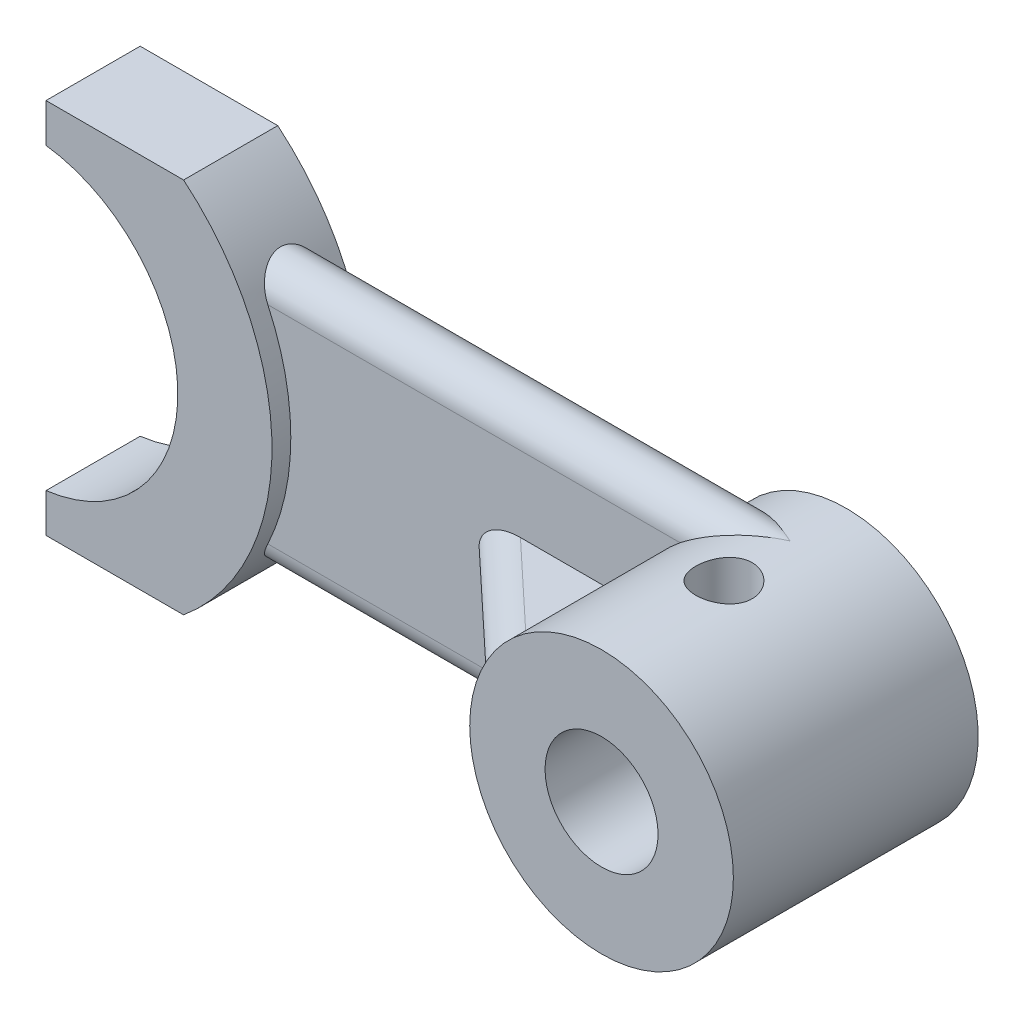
SolidWorks part; units mm, degrees
ref_plane "前视基准面" through (0, 0, 0) normal (0, 0, 1) x (1, 0, 0)
ref_plane "上视基准面" through (0, 0, 0) normal (0, 1, 0) x (1, 0, 0)
ref_plane "右视基准面" through (0, 0, 0) normal (1, 0, 0) x (0, 0, -1)
sketch "草图1" plane through (0, 0, 0) normal (0, 0, 1) x (1, 0, 0)
  circle A0 centre (0, 0) radius 7
  circle A1 centre (0, 0) radius 3
extrude "拉伸1" add sketch "草图1" along normal blind 10
sketch "草图2" plane through (0, 0, 0) normal (0, 0, -1) x (-1, 0, 0)
  circle A0 centre (0, 0) radius 3
  circle A1 centre (0, 0) radius 7
extrude "拉伸2" add sketch "草图2" along normal blind 3
ref_plane "基准面1" through (-28, 0, 0) normal (1, 0, 0) x (0, 0, -1)
sketch "草图4" plane through (-28, 0, 0) normal (1, 0, 0) x (0, 0, -1)
  line L0 (0, -7) -> (0, 7) construction
  line L1 (-10, -7) -> (3, -7) construction
  line L2 (3, 7) -> (-10, 7) construction
  line L3 (-1.5, 5.5) -> (-1.5, -5.5)
  line L4 (1.5, -5.5) -> (1.5, 5.5)
  arc A0 (-1.5, -5.5) -> (1.5, -5.5) centre (0, -5.5) ccw
  arc A1 (1.5, 5.5) -> (-1.5, 5.5) centre (0, 5.5) ccw
  dimension "D1" = 3
extrude "拉伸3" add sketch "草图4" along normal up to next
sketch "草图5" plane through (0, 0, 0) normal (0, 0, 1) x (1, 0, 0)
  line L0 (-38, -13.4863) -> (-38, 22.2455) construction
  line L1 (-37, 10) -> (-37, 7.9373)
  line L2 (-37, -7.9373) -> (-37, -10)
  line L3 (-37, 10) -> (-29.6934, 10)
  line L4 (0, 0) -> (-69.9953, 0) construction
  line L5 (-37, -10) -> (-29.6934, -10)
  arc A0 (-29.6934, -10) -> (-29.6934, 10) centre (-38, 0) ccw
  arc A1 (-37, -7.9373) -> (-37, 7.9373) centre (-38, 0) ccw
  dimension "D1" = 38
  dimension "D2" = 1
extrude "拉伸4" add sketch "草图5" along normal mid plane 5
sketch "草图6" plane through (0, 0, 0) normal (0, 1, 0) x (1, 0, 0)
  line L0 (-7, -9) -> (-15, -1.5)
  line L1 (-7, -1.5) -> (-7, -10) construction
  line L2 (-4.3301, -1.5) -> (-26.2208, -1.5) construction
rib "筋1" sketch "草图6" sketch "草图6" thickness 3 extrusion direction parallel to sketch draft on no parameters "D1"=3
fillet "圆角2" radius 1.5 2 edges at (-10.9187, 1.5, 5.3262) (-10.9187, -1.5, 5.3262)
sketch "草图7" plane through (0, 0, 0) normal (0, 1, 0) x (1, 0, 0)
  line L0 (0, 3) -> (0, -10) construction
  line L1 (7, 3) -> (-7, 3) construction
  line L2 (-3, -10) -> (3, -10) construction
  circle A0 centre (0, -3.5) radius 1.5
extrude "切除-拉伸1" cut sketch "草图7" against normal mid plane 20
sketch "草图8" plane through (0, 0, 0) normal (0, 1, 0) x (1, 0, 0)
  line L1 (14.4912, 28.3283) -> (-17.32, 28.3283)
  line L2 (14.4912, 28.3283) -> (14.4912, -21.0481)
  line L3 (14.4912, -21.0481) -> (-17.32, -21.0481)
  line L4 (-17.32, 28.3283) -> (-17.32, -21.0481)
extrude "切除-拉伸2" [suppressed] cut sketch "草图8" against normal through all and the other way through all
